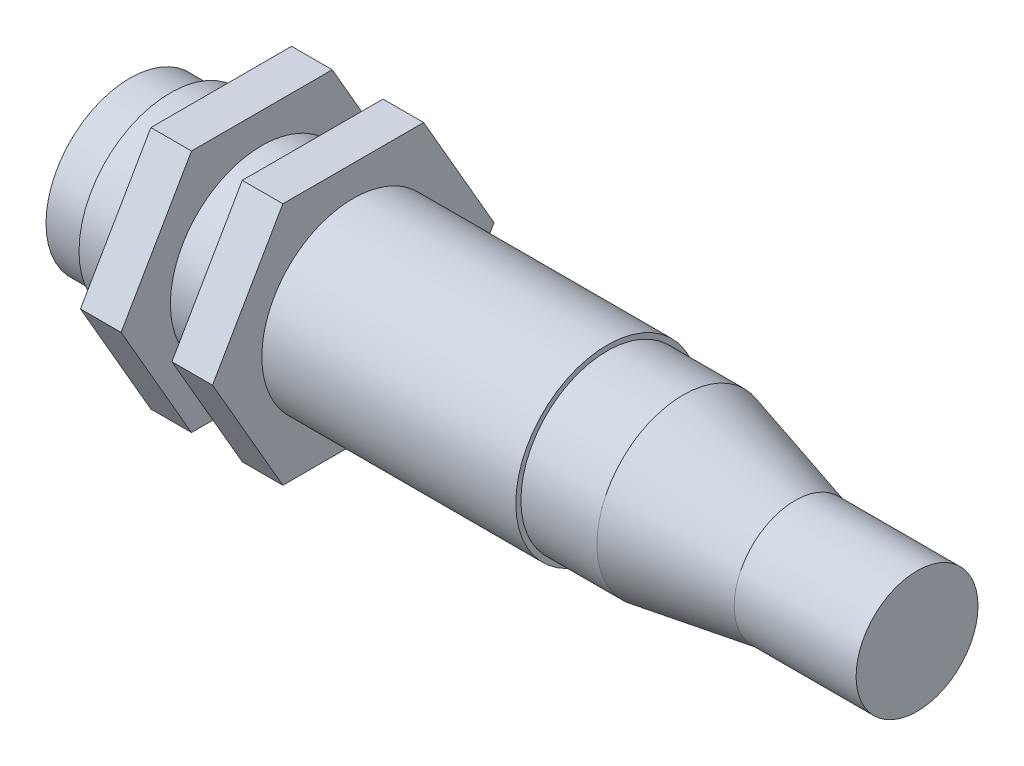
SolidWorks part; units mm, degrees
ref_plane "Plan de face" through (0, 0, 0) normal (0, 0, 1) x (1, 0, 0)
ref_plane "Plan de dessus" through (0, 0, 0) normal (0, 1, 0) x (1, 0, 0)
ref_plane "Plan de droite" through (0, 0, 0) normal (1, 0, 0) x (0, 0, -1)
sketch "Esquisse1" plane through (0, 0, 0) normal (0, 0, 1) x (1, 0, 0)
  line L1 (0, 0) -> (43, 0)
  line L2 (0, 0) -> (0, 9)
  line L3 (0, 9) -> (43, 9)
  line L4 (43, 0) -> (43, 9)
  dimension "D1" = 43
  dimension "D2" = 9
revolve "Révolution1" add sketch "Esquisse1" angle 360 about L1
sketch "Esquisse2" plane through (0, 0, 0) normal (-1, 0, 0) x (0, 0, 1)
  circle A0 centre (0, 0) radius 8.25
  dimension "D1" = 16.5
extrude "Extrusion1" add sketch "Esquisse2" along normal blind 4
sketch "Esquisse3" plane through (43, 0, 0) normal (1, 0, 0) x (0, 0, -1)
  circle A0 centre (0, 0) radius 8.5
  dimension "D1" = 17
extrude "Extrusion2" add sketch "Esquisse3" along normal blind 7.5
ref_plane "Plan1" through (61.5, 0, 0) normal (1, 0, 0) x (0, 0, -1)
sketch "Esquisse4" plane through (61.5, 0, 0) normal (1, 0, 0) x (0, 0, -1)
  circle A0 centre (0, -1) radius 6
  dimension "D1" = 1
  dimension "D2" = 12
extrude "Extrusion3" add sketch "Esquisse4" along normal blind 12
loft "Lissage3" add
ref_plane "Plan2" through (5, 0, 0) normal (1, 0, 0) x (0, 0, -1)
sketch "Esquisse5" plane through (5, 0, 0) normal (1, 0, 0) x (0, 0, -1)
  line L1 (6.9282, 12) -> (-6.9282, 12)
  line L2 (-6.9282, 12) -> (-13.8564, 0)
  line L3 (-13.8564, 0) -> (-6.9282, -12)
  line L4 (-6.9282, -12) -> (6.9282, -12)
  line L5 (6.9282, -12) -> (13.8564, 0)
  line L6 (13.8564, 0) -> (6.9282, 12)
  circle A0 centre (0, 0) radius 12 construction
  circle A1 centre (0, 0) radius 9
  dimension "D2" = 18
  dimension "D1" = 24
extrude "Extrusion4" add sketch "Esquisse5" along normal blind 4 separate body
pattern_linear "Répétition linéaire2" count 2 spacing 24 along (1, 0, 0)
